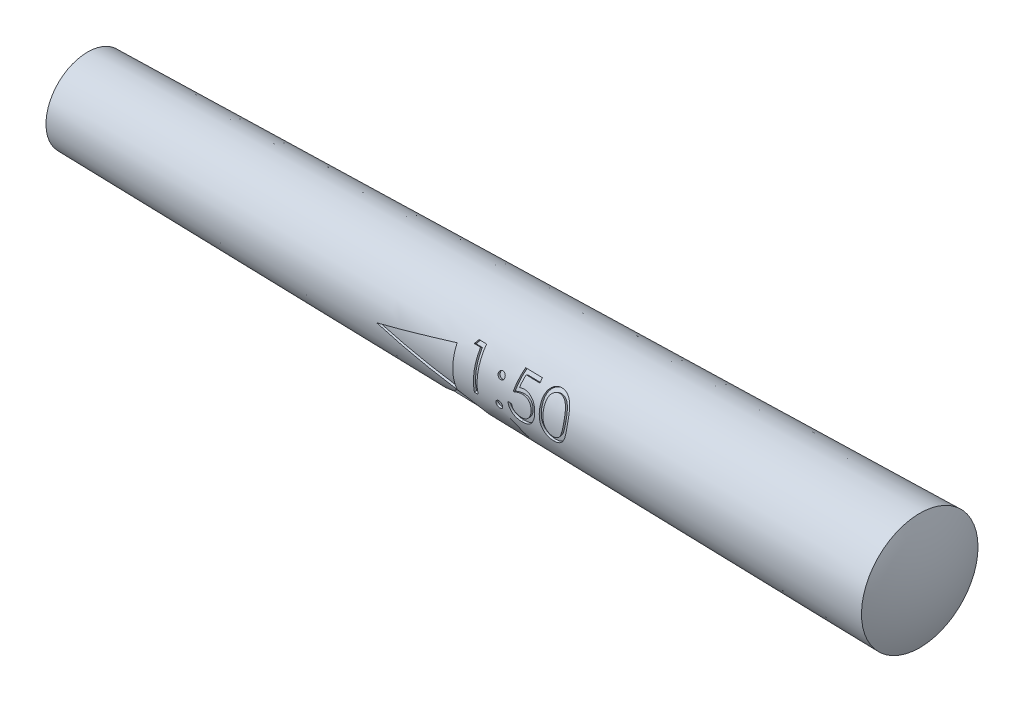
SolidWorks part; units mm, degrees
ref_plane "Front Plane" through (0, 0, 0) normal (0, 0, 1) x (1, 0, 0)
ref_plane "Top Plane" through (0, 0, 0) normal (0, 1, 0) x (1, 0, 0)
ref_plane "Right Plane" through (0, 0, 0) normal (1, 0, 0) x (0, 0, -1)
sketch "Sketch1" plane through (0, 0, 0) normal (1, 0, 0) x (0, 0, -1)
  circle A0 centre (0, 0) radius 1
  dimension "D1" = 2
extrude "Extrude1" add sketch "Sketch1" along normal mid plane 20
draft "Draft1" type of draft neutral plane draft angle 1.146 faces to draft 1 parameters "D1"=1.146
sketch "Sketch2" plane through (0, 0, 0) normal (0, 0, 1) x (1, 0, 0)
  line L0 (-10, 0) -> (-10, 1)
  line L1 (-10, 1) -> (-10, -1) construction
  line L2 (-10, 0) -> (-10.3, 0)
  line L3 (-10.3, 0) -> (-10.3, -1.2) construction
  line L4 (10, 0) -> (10, 1.4)
  line L5 (10, -1.4) -> (10, 1.4) construction
  line L6 (10, 0) -> (10.3, 0)
  line L7 (10.3, 0) -> (10.3, -1.2) construction
  line L8 (-10, -1) -> (10, -1.4) construction
  arc A0 (-10.3, 0) -> (-10, 1) centre (-8.4833, 0) cw
  arc A1 (10.3, 0) -> (10, 1.4) centre (6.8833, 0) ccw
  point P14 (0, -1.2)
revolve "Revolve1" add sketch "Sketch2" angle 360 about L2
sketch "Sketch5" plane through (0, 0, 0) normal (0, 0, 1) x (1, 0, 0)
  line L0 (0, 1.2) -> (0, -1.2) construction
  line L1 (10, 1.4) -> (-10, 1) construction
  line L2 (-10, -1) -> (10, -1.4) construction
ref_plane "Plane2" through (0, 0, 0) normal (-0.02, 0, 0.9998) x (0.9998, 0, 0.02)
sketch "Sketch6" plane through (0, 0, 0) normal (-0.02, 0, 0.9998) x (0.9998, 0, 0.02)
  line L0 (0, 0) -> (0, 0.5)
  line L1 (0, 1.2) -> (0, -1.2) construction
  line L2 (0, 0.5) -> (-1.866, 0)
  line L3 (-1.866, 0) -> (0, -0.5)
  line L4 (0, -0.5) -> (0, 0)
  line L5 (0, -0.25) -> (3, -0.25) construction
  text T0 "1:50" font "Century Gothic" height 1
  dimension "D1" = 1
  dimension "D2" = 30
  dimension "D3" = 3
wrap "Wrap2" sketch "Sketch6" wrap type deboss source sketch "Sketch6" thickness 0.05 parameters "D1"=0.05
equation "\"D2@Sketch2\" = \"D1@Sketch2\""
